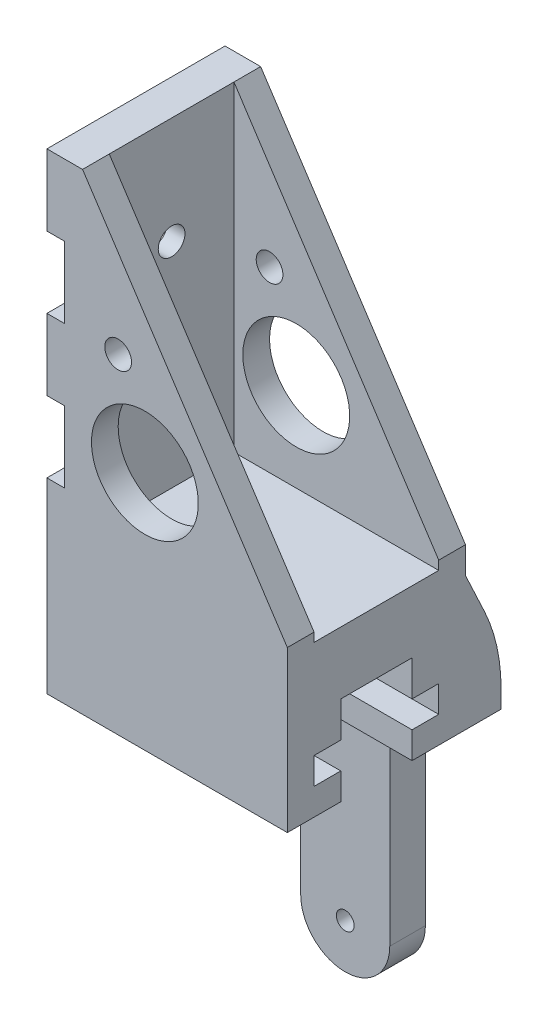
SolidWorks part; units mm, degrees
ref_plane "前视" through (0, 0, 0) normal (0, 0, 1) x (1, 0, 0)
ref_plane "上视" through (0, 0, 0) normal (0, 1, 0) x (1, 0, 0)
ref_plane "右视" through (0, 0, 0) normal (1, 0, 0) x (0, 0, -1)
sketch "草图1" plane through (0, 0, 0) normal (0, 0, 1) x (1, 0, 0)
  line L0 (0, 0) -> (2, 0)
  line L1 (2, 0) -> (25, -35)
  line L2 (25, -35) -> (25, -38)
  line L3 (25, -38) -> (0, -38)
  line L4 (0, -38) -> (0, 0)
  dimension "D1" = 38
  dimension "25" = 25
  dimension "D2" = 3
  dimension "D3" = 2
extrude "凸台-拉伸1" add sketch "草图1" along normal mid plane 20
shell "抽壳1" thickness 3
sketch "草图2" plane through (0, 0, 0) normal (0, 0, 1) x (1, 0, 0)
  line L0 (2, 0) -> (2, -36)
  line L1 (2, 0) -> (0, 0) construction
  line L2 (2, -36) -> (25, -36)
  line L3 (25, -38) -> (25, -35) construction
  line L4 (25, -36) -> (25, -35)
  line L5 (25, -35) -> (22, -30.4348)
  line L6 (22, -30.4348) -> (22, -35)
  line L7 (22, -35) -> (22, -30.4348) construction
  line L8 (3, -35) -> (22, -35) construction
  line L9 (22, -35) -> (3, -35)
  line L10 (3, -35) -> (3, -3)
  line L11 (3, -3) -> (3.9714, -3)
  line L12 (3.9714, -3) -> (2, 0)
  line L13 (0, -38) -> (25, -38) construction
  dimension "D1" = 2
extrude "切除-拉伸1" cut sketch "草图2" against normal mid plane 14
sketch "草图3" plane through (0, 0, 0) normal (0, 0, 1) x (1, 0, 0)
  line L1 (0, 0) -> (0, -38) construction
  line L2 (0, 0) -> (-2, 0)
  line L3 (0, 0) -> (0, -8)
  line L4 (0, -8) -> (-2, -8)
  line L5 (-2, 0) -> (-2, -8)
  line L6 (0, -16) -> (-2, -16)
  line L7 (0, -16) -> (0, -24)
  line L8 (0, -24) -> (-2, -24)
  line L9 (-2, -16) -> (-2, -24)
  line L10 (0, -38) -> (25, -38) construction
  line L11 (0, -32) -> (-2, -32)
  line L12 (0, -32) -> (0, -38)
  line L13 (0, -38) -> (-2, -38)
  line L14 (-2, -32) -> (-2, -38)
  dimension "D1" = 2
  dimension "D2" = 6
  dimension "D3" = 8
  dimension "D4" = 8
  dimension "D5" = 8
extrude "凸台-拉伸2" add sketch "草图3" along normal mid plane 20
sketch "草图4" plane through (0, 0, -10) normal (0, 0, -1) x (-1, 0, 0)
  line L0 (2, -38) -> (-25, -38) construction
  line L1 (0, -24) -> (0, -32) construction
  line L2 (0, -8) -> (0, -16) construction
  circle A0 centre (-9, -26) radius 6
  circle A1 centre (-6, -16) radius 1.5
  dimension "D1" = 12
  dimension "D2" = 3
  dimension "D3" = 12
  dimension "D4" = 9
  dimension "D5" = 22
  dimension "D6" = 6
extrude "切除-拉伸2" cut sketch "草图4" against normal blind 20
sketch "草图5" plane through (0, 0, 0) normal (-1, 0, 0) x (0, 0, 1)
  line L0 (0, 0) -> (0, -38) construction
  line L1 (10, -38) -> (-10, -38) construction
  line L2 (-10, -12) -> (10, -12) construction
  line L3 (-10, -8) -> (-10, -16) construction
  line L4 (10, -8) -> (10, -16) construction
  line L5 (-10, -28) -> (10, -28) construction
  line L6 (-10, -24) -> (-10, -32) construction
  line L7 (10, -24) -> (10, -32) construction
  circle A0 centre (0, -12) radius 1.5
  circle A1 centre (0, -28) radius 1.5
  dimension "D1" = 3
extrude "切除-拉伸3" cut sketch "草图5" against normal blind 20
sketch "草图6" plane through (25, 0, 0) normal (1, 0, 0) x (0, 0, -1)
  line L0 (-10, -38) -> (-10, -53)
  line L1 (-10, -38) -> (10, -38)
  line L2 (10, -38) -> (12.1176, -42.5294)
  line L3 (14, -51) -> (14, -53)
  line L4 (14, -53) -> (4, -53)
  line L7 (4, -50) -> (4, -53)
  line L8 (7, -50) -> (4, -50)
  line L9 (7, -47) -> (7, -50)
  line L10 (4, -47) -> (7, -47)
  line L11 (4, -43) -> (4, -47)
  line L12 (-4, -43) -> (4, -43)
  line L13 (-4, -43) -> (-4, -47)
  line L14 (-4, -47) -> (-7, -47)
  line L15 (-7, -47) -> (-7, -50)
  line L16 (-7, -50) -> (-4, -50)
  line L17 (-4, -50) -> (-4, -53)
  line L18 (-4, -53) -> (-10, -53)
  line L22 (0, -38) -> (0, -52.3559) construction
  arc A0 (14, -51) -> (12.1176, -42.5294) centre (-6, -51) ccw
  dimension "D8" = 20
  dimension "D1" = 15
  dimension "D2" = 3
  dimension "D3" = 3
  dimension "D4" = 4
  dimension "D5" = 6
  dimension "D6" = 3
  dimension "D7" = 6
  dimension "D9" = 10
  dimension "D10" = 2
extrude "凸台-拉伸3" add sketch "草图6" against normal up to surface (27 mm away)
sketch "草图7" plane through (0, 0, -14) normal (0, 0, -1) x (-1, 0, 0)
  line L0 (-11.5, -53) -> (-11.5, -73) construction
  line L1 (2, -53) -> (-25, -53) construction
  line L2 (-6.5, -53) -> (-6.5, -73)
  line L3 (-16.5, -53) -> (-16.5, -73)
  line L4 (-16.5, -53) -> (-6.5, -53)
  circle A0 centre (-11.5, -73) radius 1
  arc A1 (-16.5, -73) -> (-6.5, -73) centre (-11.5, -73) ccw
  point P4 (-11.5, -53)
  dimension "D2" = 25
  dimension "D3" = 2
  dimension "D1" = 10
extrude "凸台-拉伸4" add sketch "草图7" against normal blind 4
sketch "草图8" plane through (0, 0, -14) normal (0, 0, -1) x (-1, 0, 0)
  line L0 (-16.5, -73) -> (-16.5, -78.3)
  line L1 (-6.5, -73) -> (-6.5, -78.3)
  arc A0 (-16.5, -78.3) -> (-6.5, -78.3) centre (-11.5, -78.3) ccw
  arc A1 (-16.5, -73) -> (-6.5, -73) centre (-11.5, -73) ccw
extrude "凸台-拉伸5" add sketch "草图8" against normal blind 4
sketch "草图9" plane through (0, 0, -14) normal (0, 0, -1) x (-1, 0, 0)
  circle A0 centre (-11.5, -73) radius 1
extrude "凸台-拉伸6" add sketch "草图9" against normal blind 4
sketch "草图10" plane through (0, 0, -14) normal (0, 0, -1) x (-1, 0, 0)
  circle A0 centre (-11.5, -78.3) radius 1
extrude "切除-拉伸4" cut sketch "草图10" against normal blind 4
